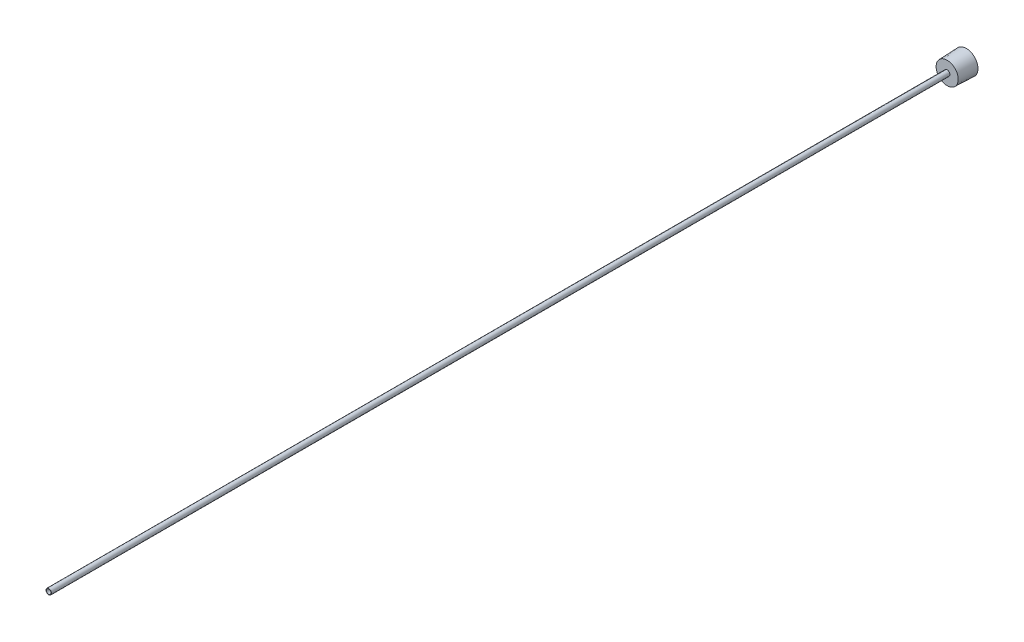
SolidWorks part; units mm, degrees
ref_plane "Front Plane" through (0, 0, 0) normal (0, 0, 1) x (1, 0, 0)
ref_plane "Top Plane" through (0, 0, 0) normal (0, 1, 0) x (1, 0, 0)
ref_plane "Right Plane" through (0, 0, 0) normal (1, 0, 0) x (0, 0, -1)
sketch "Sketch1" plane through (0, 0, 0) normal (1, 0, 0) x (0, 0, -1)
  line L0 (-304.8, 0) -> (0, 0)
  line L5 (0, 3.8989) -> (-6.35, 3.6674)
  line L6 (0, 0) -> (0, 3.8989)
  line L7 (-6.35, 3.6674) -> (-6.35, 0.9144)
  line L8 (-6.35, 0.9144) -> (-304.8, 0.9144)
  line L9 (-304.8, 0.9144) -> (-304.8, 0)
  line L10 (0, 0) -> (49989.3417, 0) construction
  dimension "D1" = 2.088
  dimension "D2" = 6.35
  dimension "D3" = 304.8
  dimension "D4" = 1.8288
  dimension "D5" = 7.7978
revolve "Revolve1" add sketch "Sketch1" angle 360 about L10
sketch "Sketch2" plane through (0, 0, 304.8) normal (0, 0, 1) x (1, 0, 0)
  circle A0 centre (0, 0) radius 0.762
  dimension "D1" = 1.524
extrude "Cut-Extrude1" cut sketch "Sketch2" against normal through all
sketch "Sketch3" plane through (0, 0, 0) normal (0, 0, -1) x (-1, 0, 0)
  line L0 (0, 4.2888) -> (0, -4.2888) construction
  line L1 (0, -2.7496) -> (2.3812, -1.3748)
  line L2 (2.3812, -1.3748) -> (2.3812, 1.3748)
  line L3 (2.3812, 1.3748) -> (0, 2.7496)
  line L4 (0, 2.7496) -> (-2.3813, 1.3748)
  line L5 (-2.3813, 1.3748) -> (-2.3813, -1.3748)
  line L6 (-2.3813, -1.3748) -> (0, -2.7496)
  circle A0 centre (0, 0) radius 2.3813 construction
  dimension "D1" = 4.7625
extrude "Cut-Extrude2" cut sketch "Sketch3" against normal blind 3.9688
